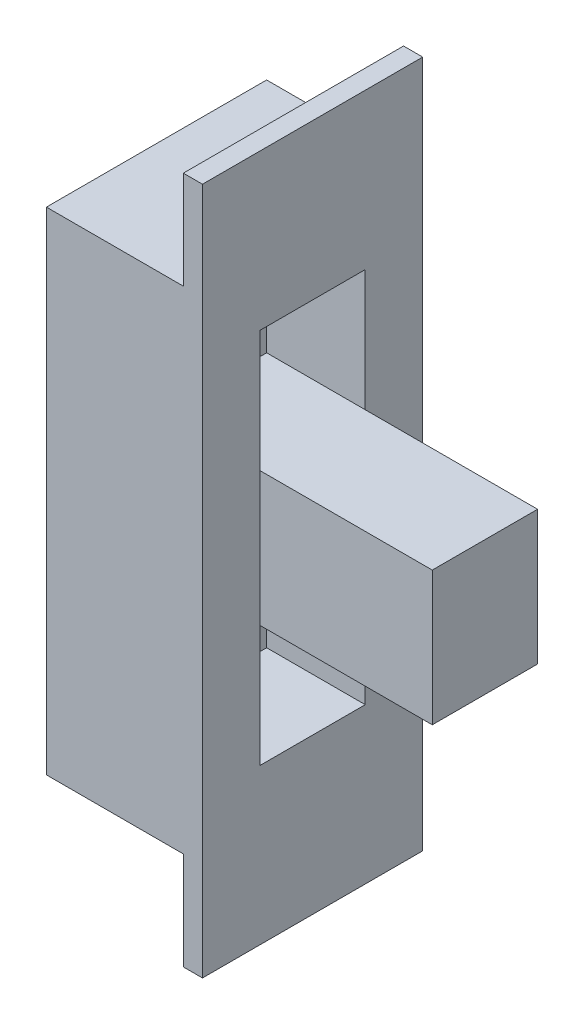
SolidWorks part; units mm, degrees
ref_plane "Plane1" through (0, 0, 0) normal (0, 0, 1) x (1, 0, 0)
ref_plane "Plane2" through (0, 0, 0) normal (0, 1, 0) x (1, 0, 0)
ref_plane "Plane3" through (0, 0, 0) normal (1, 0, 0) x (0, 0, -1)
sketch "Sketch2" plane through (0, 0, 0) normal (0, 0, 1) x (1, 0, 0)
  line L0 (-7.2426, 56.73) -> (-7.2426, 20.83)
  line L1 (-8.2426, 20.83) -> (-8.2426, 56.73)
  line L8 (-7.2426, 56.73) -> (-14.2426, 56.73) construction
  line L9 (-7.2426, 56.73) -> (-8.2426, 56.73)
  line L10 (-14.2426, 20.83) -> (-7.2426, 20.83) construction
  line L11 (-8.2426, 20.83) -> (-7.2426, 20.83)
extrude "Base-Extrude" add sketch "Sketch2" along normal blind 11.5
sketch "Sketch3" plane through (-8.2426, 0, 0) normal (-1, 0, 0) x (0, 0, 1)
  line L2 (0, 51.6191) -> (6.64, 51.6191) construction
  line L3 (0, 51.6191) -> (11.5, 51.6191)
  line L4 (0, 25.9409) -> (11.5, 25.9409)
  line L5 (0, 51.6191) -> (0, 25.9409)
  line L6 (11.5, 20.83) -> (11.5, 56.73) construction
  line L7 (11.5, 25.9409) -> (11.5, 51.6191)
extrude "Boss-Extrude1" add sketch "Sketch3" along normal blind 7.15
sketch "Sketch4" plane through (-7.2426, 0, 0) normal (1, 0, 0) x (0, 0, -1)
  line L4 (-8.5, 28.9409) -> (-8.5, 48.6191)
  line L5 (-8.5, 48.6191) -> (-3, 48.6191)
  line L6 (-3, 48.6191) -> (-3, 28.9409)
  line L7 (-3, 28.9409) -> (-8.5, 28.9409)
  line L8 (-8.5, 28.9409) -> (-8.5, 48.6191)
  line L9 (-8.5, 48.6191) -> (-3, 48.6191)
  line L10 (-3, 48.6191) -> (-3, 28.9409)
  line L11 (-3, 28.9409) -> (-8.5, 28.9409)
  dimension "D1" = 3
extrude "Cut-Extrude1" cut sketch "Sketch4" against normal offset from surface (5.15 mm away) 3
sketch "Sketch5" plane through (-12.3926, 0, 0) normal (1, 0, 0) x (0, 0, -1)
  line L0 (-8.5, 42.2794) -> (-3, 42.2794)
  line L1 (-8.5, 35.2794) -> (-3, 35.2794)
  line L4 (-3, 28.9409) -> (-3, 48.6191)
  line L5 (-3, 48.6191) -> (-8.5, 48.6191)
  line L6 (-8.5, 48.6191) -> (-8.5, 28.9409)
  line L7 (-8.5, 28.9409) -> (-3, 28.9409)
  line L8 (-3, 35.2794) -> (-3, 42.2794)
  line L10 (-8.5, 42.2794) -> (-8.5, 35.2794)
  dimension "D2" = 7
  dimension "D1" = 0
extrude "Boss-Extrude3" add sketch "Sketch5" along normal offset from surface (14.15 mm away) 9
